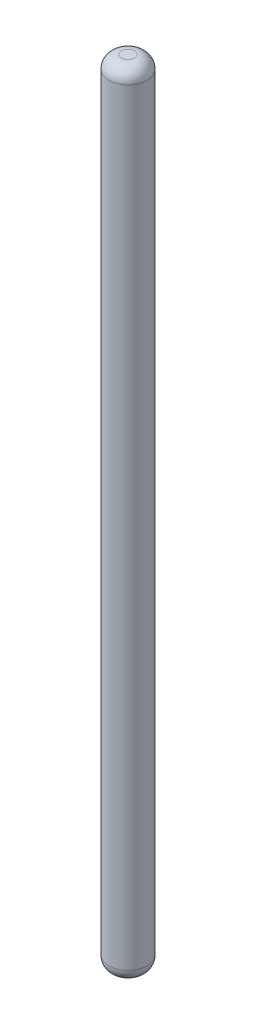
SolidWorks part; units mm, degrees
ref_plane "Front Plane" through (0, 0, 0) normal (0, 0, 1) x (1, 0, 0)
ref_plane "Top Plane" through (0, 0, 0) normal (0, 1, 0) x (1, 0, 0)
ref_plane "Right Plane" through (0, 0, 0) normal (1, 0, 0) x (0, 0, -1)
sketch "Sketch1" plane through (0, 0, 0) normal (0, 1, 0) x (1, 0, 0)
  circle A0 centre (0, 0) radius 1.5
  dimension "D1" = 3
extrude "Boss-Extrude1" add sketch "Sketch1" along normal blind 62
fillet "Fillet1" radius 1 2 edges at (0, 0, 1.5) (0, 62, 1.5)
